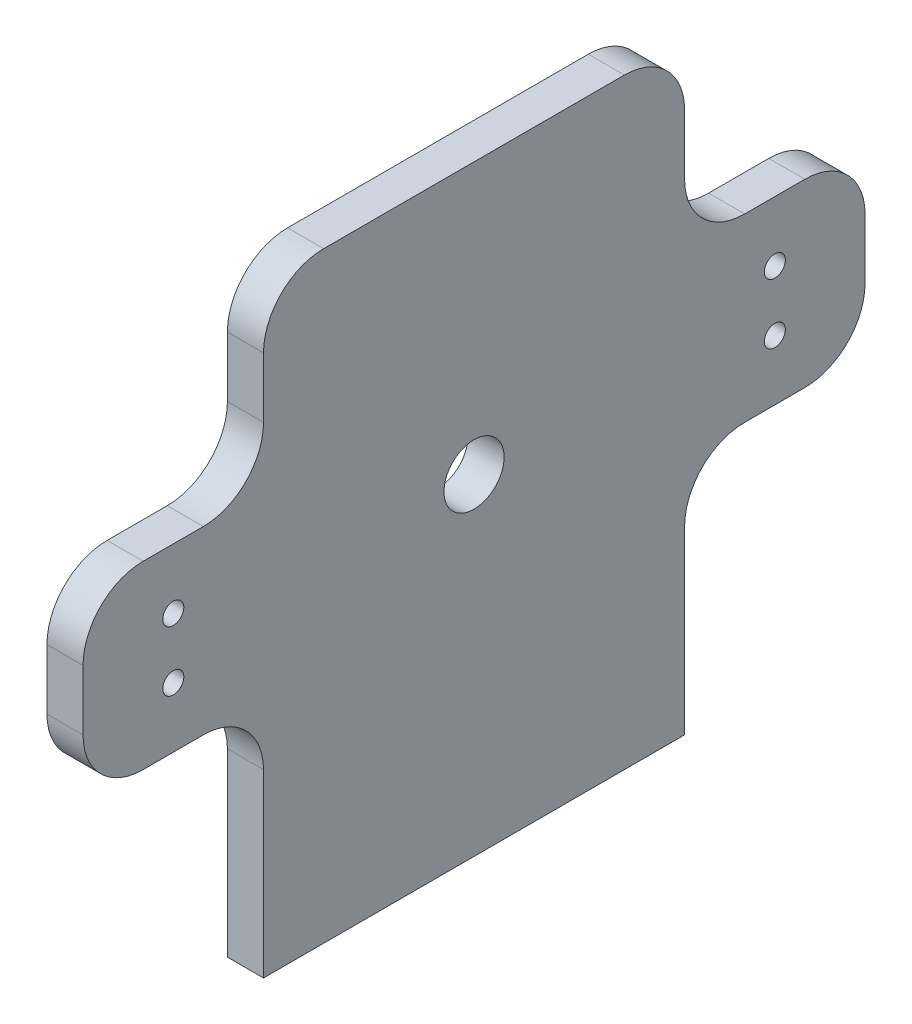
SolidWorks part; units mm, degrees
ref_plane "Front Plane" through (0, 0, 0) normal (0, 0, 1) x (1, 0, 0)
ref_plane "Top Plane" through (0, 0, 0) normal (0, 1, 0) x (1, 0, 0)
ref_plane "Right Plane" through (0, 0, 0) normal (1, 0, 0) x (0, 0, -1)
sketch "Sketch1" plane through (0, 0, 0) normal (1, 0, 0) x (0, 0, -1)
  line L0 (-37.782, 55) -> (35, 55) construction
  line L1 (0, 0) -> (70, 0)
  line L2 (0, 0) -> (0, 40)
  line L3 (0, 100) -> (70, 100)
  line L4 (70, 0) -> (70, 40)
  line L5 (35, 0) -> (35, 100) construction
  line L6 (0, 70) -> (-30, 70)
  line L7 (-30, 70) -> (-30, 40)
  line L8 (0, 40) -> (-30, 40)
  line L9 (70, 40) -> (100, 40)
  line L10 (100, 70) -> (100, 40)
  line L11 (70, 70) -> (100, 70)
  line L12 (70, 70) -> (70, 100)
  line L13 (0, 70) -> (0, 100)
  point P13 (-30, 55)
  dimension "D1" = 70
  dimension "D2" = 100
  dimension "D3" = 55
  dimension "D4" = 15
  dimension "D5" = 30
extrude "Extrude1" add sketch "Sketch1" along normal blind 6
sketch "Sketch2" plane through (0, 0, 0) normal (0, -1, 0) x (1, 0, 0)
  line L0 (3, 0) -> (3, -70) construction
  line L1 (6, 0) -> (0, 0) construction
  line L2 (6, -70) -> (0, -70) construction
  line L3 (0, -35) -> (6, -35) construction
  line L4 (0, 0) -> (0, -70) construction
  line L5 (6, 0) -> (6, -70) construction
  point P12 (3, -50)
  point P13 (3, -20)
  dimension "D1" = 15
  dimension "D2" = 15
hole_wizard "M3 Tapped Hole1" positions "3DSketch1" profile "Sketch3" tap size "M3" standard "ISO"
sketch3d "3DSketch1"
  point P0 (3, 0, -20)
  point P3 (3, 0, -50)
sketch "Sketch3" plane through (3, 0, -20) normal (1, 0, 0) x (0, 0, -1)
  line L0 (0, 0) -> (0, 10.7511)
  line L1 (0, 10.7511) -> (1.25, 10)
  line L2 (1.25, 10) -> (1.25, 6)
  line L3 (1.25, 6) -> (1.5, 6)
  line L4 (1.5, 6) -> (1.5, 0)
  line L5 (1.5, 0) -> (0, 0)
  line L10 (0, 10.7511) -> (-1.25, 10) construction
  line L11 (0, -6.35) -> (0, 107.95) construction
  dimension "Tap Drill Dia." = 2.5
  dimension "Tap Drill Depth" = 10
  dimension "Thread Major Dia." = 3
  dimension "Thread Depth" = 6
  dimension "Drill Angle" = 118
sketch "Sketch4" plane through (6, 0, 0) normal (1, 0, 0) x (0, 0, -1)
  line L0 (35, 100) -> (35, 0) construction
  line L1 (70, 100) -> (0, 100) construction
  line L2 (0, 0) -> (70, 0) construction
  circle A0 centre (35, 55) radius 5
  dimension "D1" = 10
  dimension "D2" = 55
extrude "Extrude2" cut sketch "Sketch4" against normal through all
sketch "Sketch5" plane through (6, 0, 0) normal (1, 0, 0) x (0, 0, -1)
  line L0 (35, 55) -> (70, 55) construction
  line L1 (70, 0) -> (70, 40) construction
  line L2 (85, 64.9868) -> (85, 45.6398) construction
  line L3 (35, 55) -> (35, 75.3483) construction
  line L4 (0, 0) -> (70, 0) construction
  circle A0 centre (85, 60) radius 1.75
  circle A1 centre (85, 50) radius 1.75
  circle A2 centre (-15, 50) radius 1.75
  circle A3 centre (-15, 60) radius 1.75
  circle A4 centre (35, 55) radius 5 construction
  dimension "D1" = 3.5
  dimension "D2" = 3.5
  dimension "D3" = 5
  dimension "D4" = 10
  dimension "D5" = 50
  dimension "D6" = 55
extrude "Extrude3" cut sketch "Sketch5" against normal through all
fillet "Fillet1" radius 10 10 edges at (3, 40, -70) (3, 40, 0) (3, 70, -70) (3, 70, 0) (3, 40, -100) (3, 70, -100) (3, 40, 30) (3, 70, 30) (3, 100, -70) (3, 100, 0)
